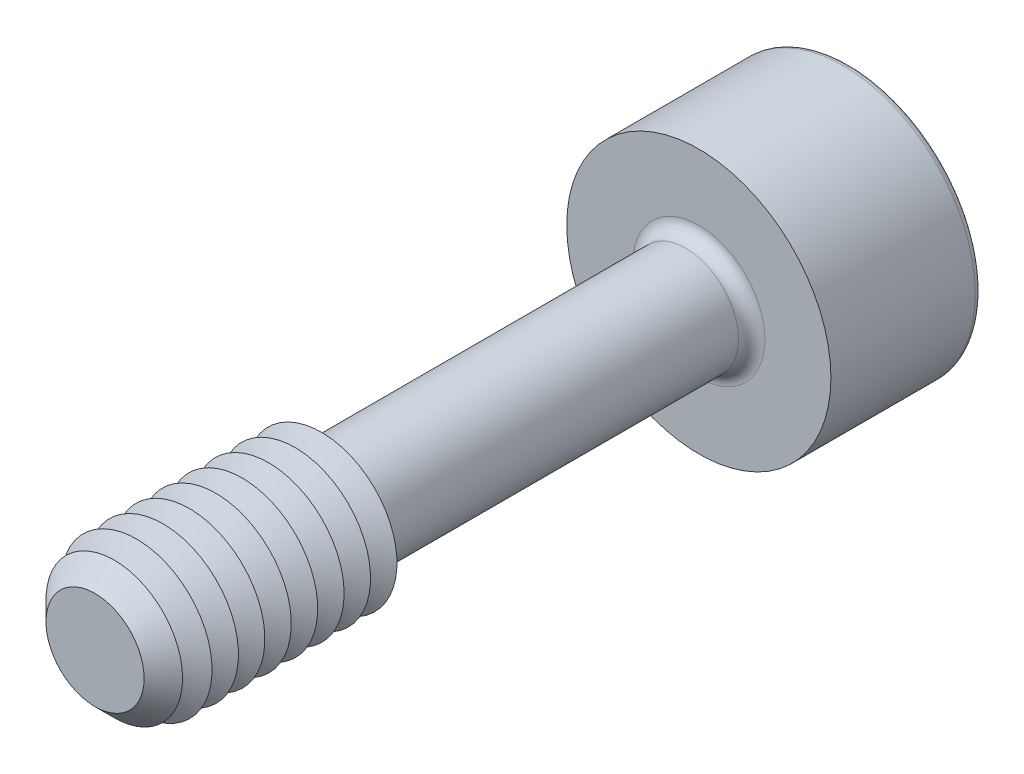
SolidWorks part; units mm, degrees
ref_plane "Front Plane" through (0, 0, 0) normal (0, 0, 1) x (1, 0, 0)
ref_plane "Top Plane" through (0, 0, 0) normal (0, 1, 0) x (1, 0, 0)
ref_plane "Right Plane" through (0, 0, 0) normal (1, 0, 0) x (0, 0, -1)
sketch "Sketch1" plane through (0, 0, 0) normal (0, 0, 1) x (1, 0, 0)
  circle A0 centre (0, 0) radius 1.4
  dimension "D1" = 2.8
extrude "Extrude1" add sketch "Sketch1" along normal mid plane 16
sketch "Sketch2" plane through (0, 0, 0) normal (1, 0, 0) x (0, 0, -1)
  line L0 (-8, 0) -> (-8, 2)
  line L1 (-8, 1.4) -> (-8, -1.4) construction
  line L2 (-8, 2) -> (-2, 2)
  line L3 (-2, 2) -> (-1.6536, 1.4)
  line L4 (8, 1.4) -> (-8, 1.4) construction
  line L5 (-1.6536, 1.4) -> (-1.6536, 0)
  line L6 (-1.6536, 0) -> (-8, 0)
  dimension "D1" = 2
  dimension "D2" = 120
  dimension "D3" = 6
revolve "Revolve1" add sketch "Sketch2" angle 360 about L6
chamfer "Chamfer1" distance 0.7 angle 45 1 edges at (0, 2, 8)
sketch "Sketch3" plane through (0, 0, -8) normal (0, 0, -1) x (-1, 0, 0)
  circle A0 centre (0, 0) radius 3.5
  dimension "D1" = 7
extrude "Extrude2" add sketch "Sketch3" along normal blind 4
sketch "Sketch4" plane through (-13.7, 0, -12) normal (0, 0, 1) x (1, 0, 0)
  line L2 (12.834, -1.5) -> (14.566, -1.5)
  line L3 (14.566, -1.5) -> (15.4321, 0)
  line L4 (15.4321, 0) -> (14.566, 1.5)
  line L6 (14.566, 1.5) -> (12.834, 1.5)
  line L7 (12.834, 1.5) -> (11.9679, 0)
  line L8 (11.9679, 0) -> (12.834, -1.5)
  circle A0 centre (13.7, 0) radius 1.5 construction
  dimension "D1" = 3
extrude "Extrude3" cut sketch "Sketch4" along normal blind 3
fillet "Fillet1" radius 0.35 1 edges at (-1.4, 0, -8)
fillet "Fillet2" radius 0.175 1 edges at (-3.5, 0, -12)
sketch "Sketch5" plane through (0, 0, 0) normal (1, 0, 0) x (0, 0, -1)
  line L0 (9, 0) -> (9, -1.5)
  line L1 (9, -1.5) -> (8.134, 0)
  line L2 (8.134, 0) -> (9, 0)
  dimension "D1" = 30
revolve "Cut-Revolve1" cut sketch "Sketch5" angle 360 about L2
sketch "Sketch6" plane through (0, 0, 0) normal (1, 0, 0) x (0, 0, -1)
  line L0 (1.332, 0) -> (-13.289, 0) construction
sketch "Sketch7" plane through (0, 0, 0) normal (1, 0, 0) x (0, 0, -1)
  line L0 (-2, 2) -> (-2.35, 1.3938)
  line L1 (-2.35, 1.3938) -> (-2.7, 2)
  line L2 (-2, 2) -> (-7.3, 2) construction
  line L3 (-2.7, 2) -> (-2, 2)
  dimension "D1" = 0.7
revolve "Cut-Revolve2" cut sketch "Sketch7" angle 360 about L0
pattern_linear "LPattern1" count 8 spacing 0.7 along (0, 0, 1) of "Cut-Revolve2"
